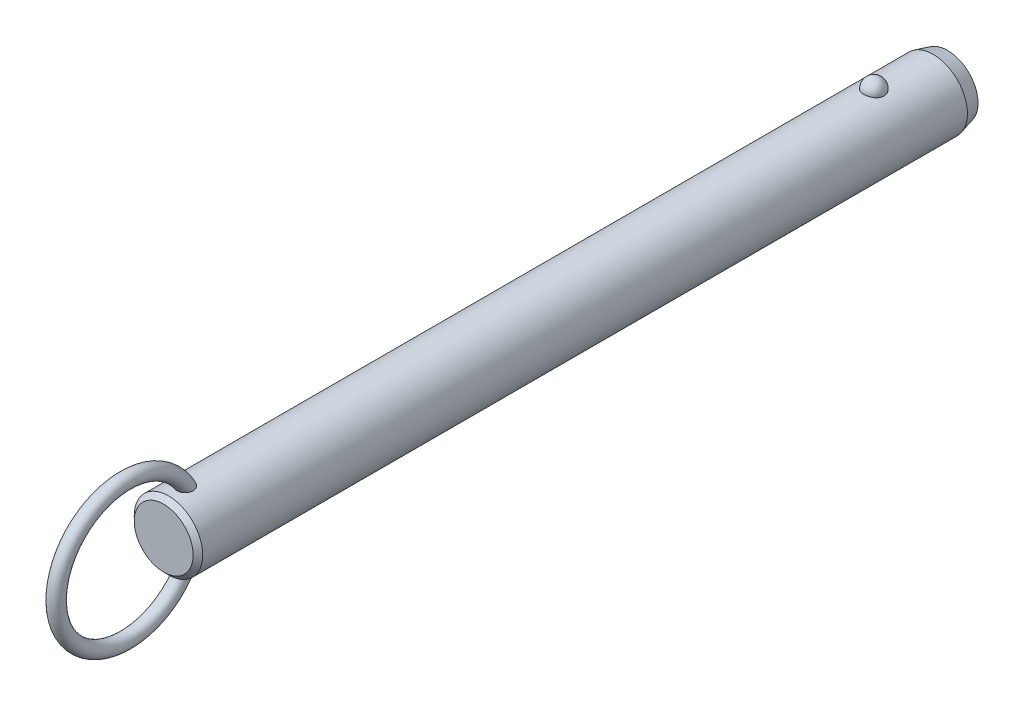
SolidWorks part; units mm, degrees
ref_plane "Front Plane" through (0, 0, 0) normal (0, 0, 1) x (1, 0, 0)
ref_plane "Top Plane" through (0, 0, 0) normal (0, 1, 0) x (1, 0, 0)
ref_plane "Right Plane" through (0, 0, 0) normal (1, 0, 0) x (0, 0, -1)
sketch "Sketch2" plane through (0, 0, 0) normal (0, 0, 1) x (1, 0, 0)
  circle A0 centre (0, 0) radius 7.1
  point P3 (0, 7.1)
  dimension "D1" = 14.2
extrude "Boss-Extrude1" add sketch "Sketch2" along normal blind 137.2
sketch "Sketch3" plane through (0, 0, 0) normal (0, 0, -1) x (-1, 0, 0)
  circle A0 centre (0, 0) radius 7.1
  dimension "D1" = 14.2
extrude "Boss-Extrude2" add sketch "Sketch3" along normal blind 17.4
chamfer "Chamfer1" distance 3 angle 15 1 edges at (-7.1, 0, -17.4)
sketch "Sketch12" plane through (0, 0, 0) normal (1, 0, 0) x (0, 0, -1)
  line L0 (-137.2, 7.1) -> (-137.2, -7.1) construction
  point P0 (-137.2, 0)
sketch "Sketch13" plane through (0, 0, 0) normal (1, 0, 0) x (0, 0, -1)
  circle A0 centre (-153.05, 0) radius 15.85
  point P2 (-137.2, 0)
  dimension "D1" = 31.7
sketch "Sketch14" plane through (0, 0, 0) normal (0, 1, 0) x (1, 0, 0)
  circle A0 centre (0, -138.7) radius 1.5
  point P2 (0, -137.2)
  dimension "D1" = 3
sweep "Sweep1" add profiles "Sketch14" path "Sketch13"
sketch "Sketch15" plane through (0, 0, 137.2) normal (0, 0, 1) x (1, 0, 0)
  circle A0 centre (0, 0) radius 7.1
  dimension "D1" = 14.2
extrude "Boss-Extrude3" add sketch "Sketch15" along normal blind 7.92
chamfer "Chamfer2" distance 1 angle 45 1 edges at (7.1, 0, 145.12)
sketch "Sketch18" plane through (0, 0, 0) normal (1, 0, 0) x (0, 0, -1)
  line L0 (14.4, 7.1) -> (-138.8792, 7.1) construction
  line L1 (2.1, 9.2) -> (2.1, 5)
  line L2 (-138.8792, -7.1) -> (14.4, -7.1) construction
  arc A0 (2.1, 9.2) -> (2.1, 5) centre (2.1, 7.1) ccw
  point P4 (0, 7.1)
  dimension "D1" = 16.3
revolve "Revolve1" add sketch "Sketch18" angle 360 about L1
